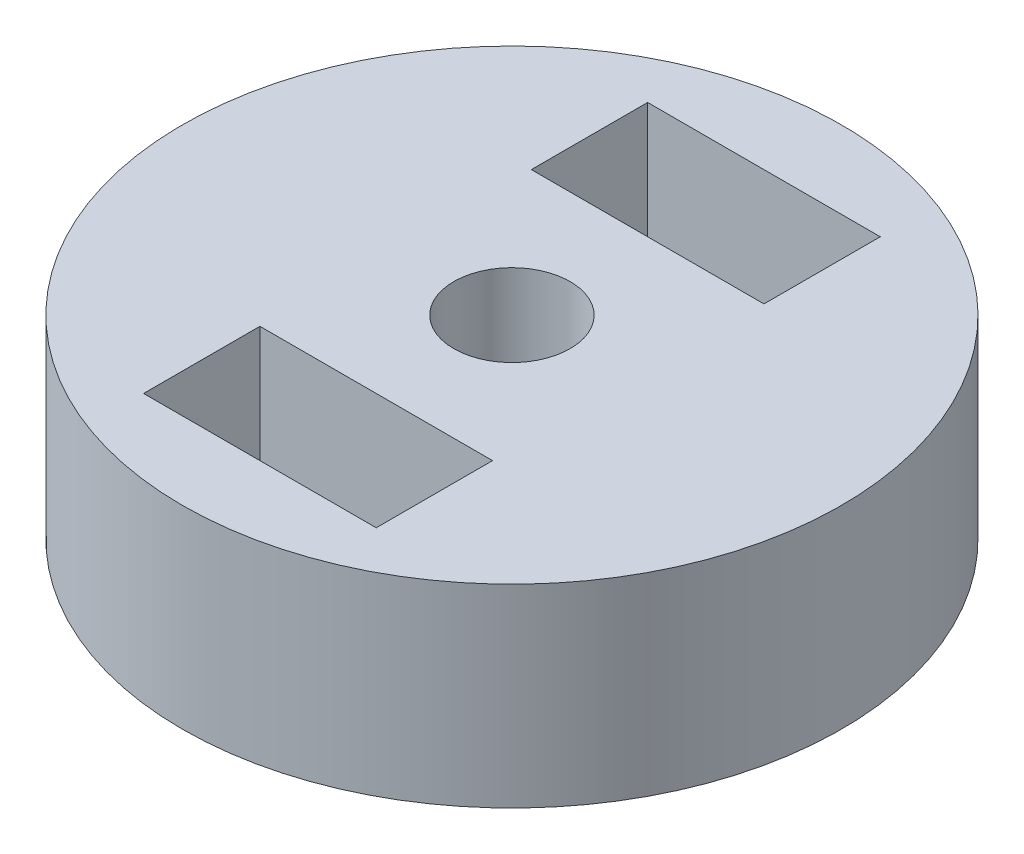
SolidWorks part; units mm, degrees
ref_plane "Front" through (0, 0, 0) normal (0, 0, 1) x (1, 0, 0)
ref_plane "Top" through (0, 0, 0) normal (0, 1, 0) x (1, 0, 0)
ref_plane "Right" through (0, 0, 0) normal (1, 0, 0) x (0, 0, -1)
sketch "草图1" plane through (0, 0, 0) normal (0, 1, 0) x (1, 0, 0)
  circle A0 centre (0, 0) radius 8.5
  circle A1 centre (0, 0) radius 1.5
  dimension "D1" = 17
  dimension "D2" = 3
extrude "凸台-拉伸1" add sketch "草图1" along normal blind 5
sketch "草图2" plane through (0, 5, 0) normal (0, 1, 0) x (1, 0, 0)
  line L1 (-3, -3.5) -> (3, -3.5)
  line L14 (-3, -3.5) -> (-3, -6.5)
  line L15 (-3, -6.5) -> (3, -6.5)
  line L16 (3, -6.5) -> (3, -3.5)
  line L17 (-3, 3.5) -> (3, 3.5)
  line L18 (3, 3.5) -> (3, 6.5)
  line L19 (3, 6.5) -> (-3, 6.5)
  line L20 (-3, 6.5) -> (-3, 3.5)
  circle A0 centre (0, 0) radius 1.5 construction
  point P6 (0, -3.5)
  point P13 (0, 3.5)
  dimension "D1" = 3.5
  dimension "D2" = 6
  dimension "D4" = 6
  dimension "D5" = 3
  dimension "D6" = 3
  dimension "D7" = 3.5
extrude "切除-拉伸1" cut sketch "草图2" against normal blind 5
